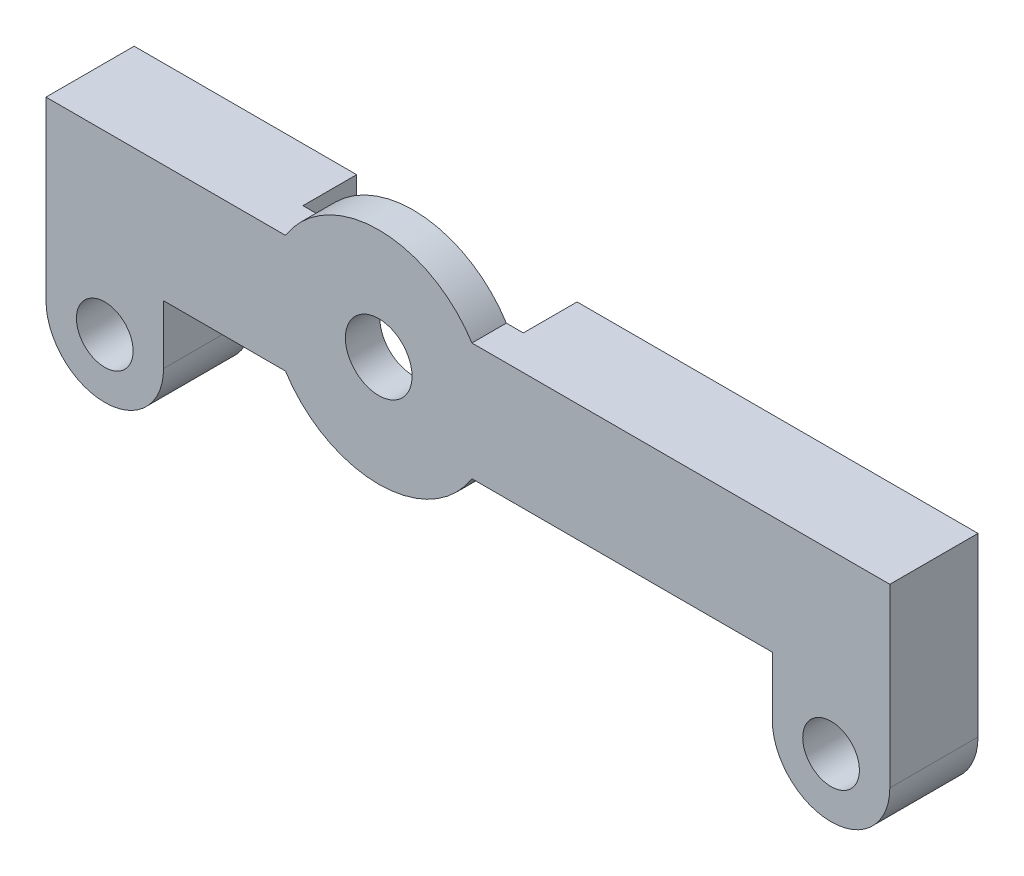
SolidWorks part; units mm, degrees
ref_plane "Front Plane" through (0, 0, 0) normal (0, 0, 1) x (1, 0, 0)
ref_plane "Top Plane" through (0, 0, 0) normal (0, 1, 0) x (1, 0, 0)
ref_plane "Right Plane" through (0, 0, 0) normal (1, 0, 0) x (0, 0, -1)
sketch "Sketch1" plane through (0, 0, 0) normal (0, 0, 1) x (1, 0, 0)
  line L0 (0, 0) -> (0, 5.6) construction
  line L1 (0, 0) -> (-17.3, 0) construction
  line L2 (0, 5.6) -> (-4.25, 5.6) construction
  line L3 (-14.5, 0) -> (-14.5, 2.8)
  line L4 (-14.5, 2.8) -> (14.5, 2.8)
  line L5 (-20.1, 0) -> (-20.1, 8.4)
  line L6 (-20.1, 8.4) -> (20.1, 8.4)
  line L7 (14.5, 0) -> (14.5, 2.8)
  line L8 (20.1, 0) -> (20.1, 8.4)
  circle A0 centre (-17.3, 0) radius 1.35
  circle A1 centre (-4.25, 5.6) radius 1.5875
  arc A2 (-20.1, 0) -> (-14.5, 0) centre (-17.3, 0) ccw
  circle A3 centre (17.3, 0) radius 1.35
  arc A4 (20.1, 0) -> (14.5, 0) centre (17.3, 0) cw
  point P18 (0, 2.8)
  point P19 (0, 8.4)
  dimension "D4" = 2.7
  dimension "D5" = 2.8
  dimension "D6" = 2.8
  dimension "D7" = 3.175
  dimension "D1" = 17.3
  dimension "D2" = 5.6
  dimension "D3" = 4.25
extrude "Body" add sketch "Sketch1" along normal blind 4.2
sketch "Sketch2" plane through (0, 0, 0) normal (0, 0, -1) x (-1, 0, 0)
  line L0 (4.25, 4.0125) -> (4.25, 7.1875) construction
  line L1 (14.5, 2.8) -> (-14.5, 2.8) construction
  line L2 (9.5, 2.8) -> (-1, 2.8)
  line L3 (9.5, 2.8) -> (9.5, 8.4)
  line L4 (9.5, 8.4) -> (-1, 8.4)
  line L5 (-1, 2.8) -> (-1, 8.4)
  line L6 (-20.1, 8.4) -> (20.1, 8.4) construction
  circle A0 centre (4.25, 5.6) radius 1.5875 construction
  dimension "D1" = 5.25
extrude "Pulley Clearance" cut sketch "Sketch2" against normal blind 2.56
sketch "Sketch3" plane through (0, 0, 4.2) normal (0, 0, 1) x (1, 0, 0)
  circle A0 centre (-4.25, 5.6) radius 5.25
  circle A1 centre (-4.25, 5.6) radius 1.625
  dimension "D1" = 10.5
extrude "Pulley Block" add sketch "Sketch3" against normal up to surface (1.64 mm away)
ref_point "Ref Center"
equation "\"D7@Sketch1\"=\"pin diameter@values@params.sldprt\""
